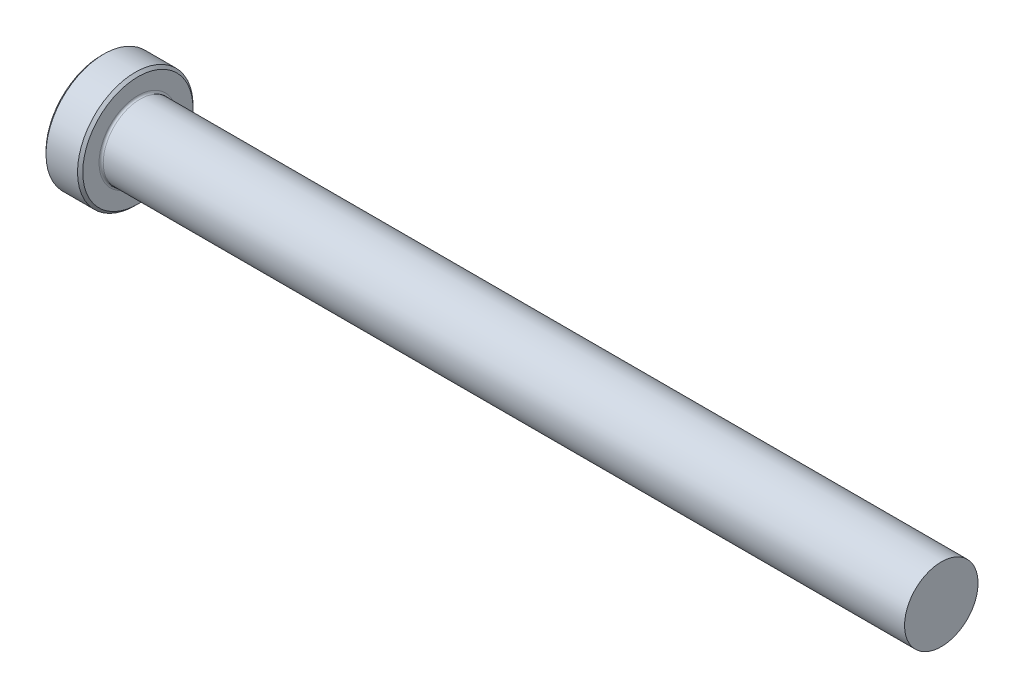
SolidWorks part; units mm, degrees
ref_plane "Plano frontal" through (0, 0, 0) normal (0, 0, 1) x (1, 0, 0)
ref_plane "Plano superior" through (0, 0, 0) normal (0, 1, 0) x (1, 0, 0)
ref_plane "Plano direito" through (0, 0, 0) normal (1, 0, 0) x (0, 0, -1)
sketch "Esboço1" plane through (0, 0, 0) normal (0, 0, 1) x (1, 0, 0)
  line L0 (0, 0) -> (189.4746, 0) construction
  line L1 (0, 0) -> (0, 10.5)
  line L2 (0.5, 11) -> (6.5, 11)
  line L3 (7, 10.5) -> (7, 7.4)
  line L4 (7.4, 7) -> (160, 7)
  line L5 (160, 7) -> (160, 0)
  line L6 (160, 0) -> (0, 0)
  line L7 (0, 10.5) -> (0.5, 11)
  line L8 (6.5, 11) -> (7, 10.5)
  arc A0 (7, 7.4) -> (7.4, 7) centre (7.4, 7.4) ccw
  point P4 (7, 11)
  point P5 (0, 11)
  dimension "D5" = 0.4
  dimension "D1" = 14
  dimension "D2" = 160
  dimension "D3" = 7
  dimension "D4" = 22
revolve "Revolução1" add sketch "Esboço1" angle 360 about L0
sketch "Esboço2" [suppressed] plane through (0, 0, 0) normal (0, 0, 1) x (1, 0, 0)
  line L0 (0, 0) -> (200.1288, 0) construction
  line L1 (0, 0) -> (0, 7)
  line L4 (0, 7) -> (175, 7)
  line L5 (175, 7) -> (175, 0)
  line L6 (175, 0) -> (0, 0)
  dimension "D1" = 175
  dimension "D2" = 14
revolve "Revolução2" [suppressed] add sketch "Esboço2" angle 360 about L0
sketch "Esboço3"
  dimension "D1" = 20.8
  dimension "D2" = 17
  dimension "D3" = 13.2
  dimension "D4" = 5.3
  dimension "D5" = 6.3
wrap "Envolver1" sketch "Esboço3" wrap type deboss source sketch "Esboço3" thickness 0.1 parameters "D1"=0.1
